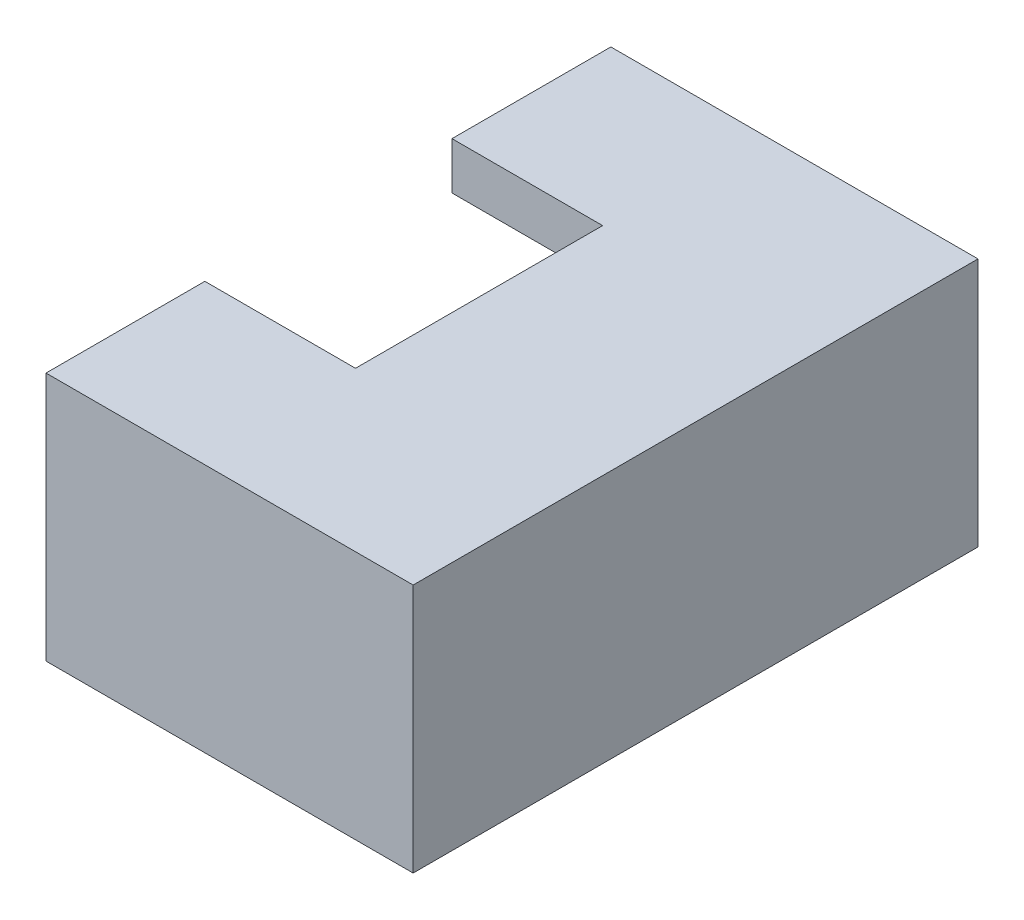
SolidWorks part; units mm, degrees
ref_plane "Plan de face" through (0, 0, 0) normal (0, 0, 1) x (1, 0, 0)
ref_plane "Plan de dessus" through (0, 0, 0) normal (0, 1, 0) x (1, 0, 0)
ref_plane "Plan de droite" through (0, 0, 0) normal (1, 0, 0) x (0, 0, -1)
ref_plane "Plan1" through (0, 0, -3.6) normal (0, 0, -1) x (-1, 0, 0)
sketch "Esquisse1" plane through (0, 0, -3.6) normal (0, 0, -1) x (-1, 0, 0)
  line L0 (-7.55, 3.1) -> (-3.55, 3.1)
  line L1 (-3.55, 3.1) -> (-3.55, 3.4)
  line L2 (-3.55, 3.4) -> (-7.55, 3.4)
  line L3 (-7.55, 3.4) -> (-7.55, 3.1)
extrude "Boss.-Extru.1" add sketch "Esquisse1" against normal blind 0.3
imported_body "Importée3"
imported_body "Importée4"
imported_body "Importée5"
imported_body "Importée6"
